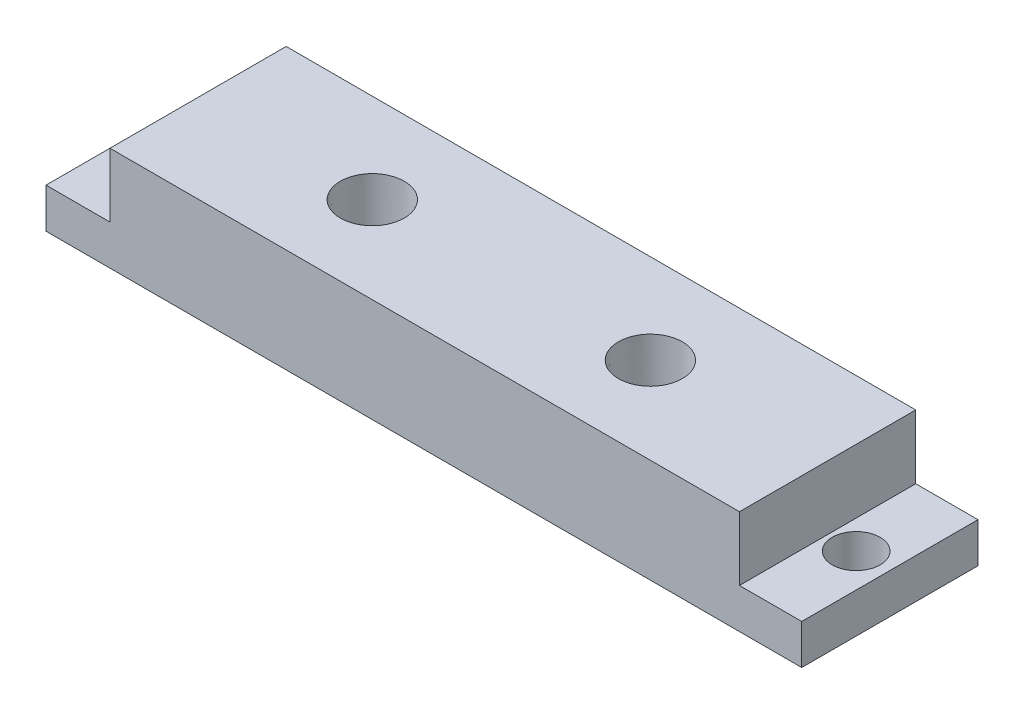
SolidWorks part; units mm, degrees
ref_plane "Front Plane" through (0, 0, 0) normal (0, 0, 1) x (1, 0, 0)
ref_plane "Top Plane" through (0, 0, 0) normal (0, 1, 0) x (1, 0, 0)
ref_plane "Right Plane" through (0, 0, 0) normal (1, 0, 0) x (0, 0, -1)
sketch "Sketch1" plane through (0, 0, 0) normal (0, 1, 0) x (1, 0, 0)
  line L0 (-84.3032, -7.2213) -> (25.7091, -7.2213) construction
  line L1 (-84.3032, 3.8123) -> (10.3014, 3.8123)
  line L2 (-84.3032, 3.8123) -> (-84.3032, -18.255)
  line L3 (-84.3032, -18.255) -> (10.3014, -18.255)
  line L4 (10.3014, 3.8123) -> (10.3014, -18.255)
  line L5 (-37.0009, 3.8123) -> (-37.0009, -33.6339) construction
  line L6 (-76.3032, 3.8123) -> (-76.3032, -18.255)
  line L7 (2.3014, 3.8123) -> (2.3014, -18.255)
  circle A0 centre (-80.1837, -7.2213) radius 3.0362
  circle A1 centre (6.0814, -7.2213) radius 3
  point P0 (0, 0)
  dimension "D1" = 8
  dimension "D2" = 8
extrude "Boss-Extrude6" add sketch "Sketch1" along normal blind 13 contours L7 L1 L6 L3 | L6 L1 L2 L3 A0 | L1 L7 L3 L4 A1
sketch "Sketch2" plane through (0, 13, 0) normal (0, 1, 0) x (1, 0, 0)
  line L1 (-84.3032, 3.8123) -> (10.3014, 3.8123) construction
  line L2 (-84.3032, -18.255) -> (10.3014, -18.255) construction
  line L4 (-76.3032, 3.8123) -> (-84.3032, 3.8123)
  line L5 (-76.3032, 3.8123) -> (-76.3032, -18.255)
  line L6 (-76.3032, -18.255) -> (-84.3032, -18.255)
  line L7 (-84.3032, 3.8123) -> (-84.3032, -18.255)
  line L9 (-76.3032, -18.255) -> (-76.3032, 3.8123)
extrude "Cut-Extrude1" cut sketch "Sketch2" against normal blind 8 contours L5 M3 M4 M1 M5
sketch "Sketch4" plane through (0, 13, 0) normal (0, 1, 0) x (1, 0, 0)
  line L0 (-76.3032, 3.8123) -> (10.3014, 3.8123) construction
  line L1 (2.5072, 3.8123) -> (10.5072, 3.8123)
  line L2 (2.5072, 3.8123) -> (2.5072, -18.255)
  line L3 (2.5072, -18.255) -> (10.5072, -18.255)
  line L4 (10.5072, 3.8123) -> (10.5072, -18.255)
  line L5 (-76.3032, -18.255) -> (10.3014, -18.255) construction
  dimension "D1" = 8
extrude "Cut-Extrude2" cut sketch "Sketch4" against normal blind 8
sketch "Sketch5" plane through (0, 13, 0) normal (0, 1, 0) x (1, 0, 0)
  line L0 (-76.3032, -7.2213) -> (2.5072, -7.2213) construction
  line L1 (-76.3032, 3.8123) -> (-76.3032, -18.255) construction
  line L2 (2.5072, 3.8123) -> (2.5072, -18.255) construction
  line L3 (-35.9855, 3.8123) -> (-36.898, 3.8123) construction
  line L4 (-76.3032, 3.8123) -> (2.5072, 3.8123) construction
  line L5 (-36.898, 3.8123) -> (-36.898, -18.255) construction
  line L6 (-76.3032, -18.255) -> (2.5072, -18.255) construction
  line L7 (-84.3032, 3.8123) -> (-84.3032, -18.255) construction
  circle A0 centre (-54.3032, -7.4076) radius 4
  circle A1 centre (-19.4928, -7.4076) radius 4
  dimension "D1" = 30
extrude "Cut-Extrude4" cut sketch "Sketch5" against normal blind 10 draft 1 contours A0 | A1
